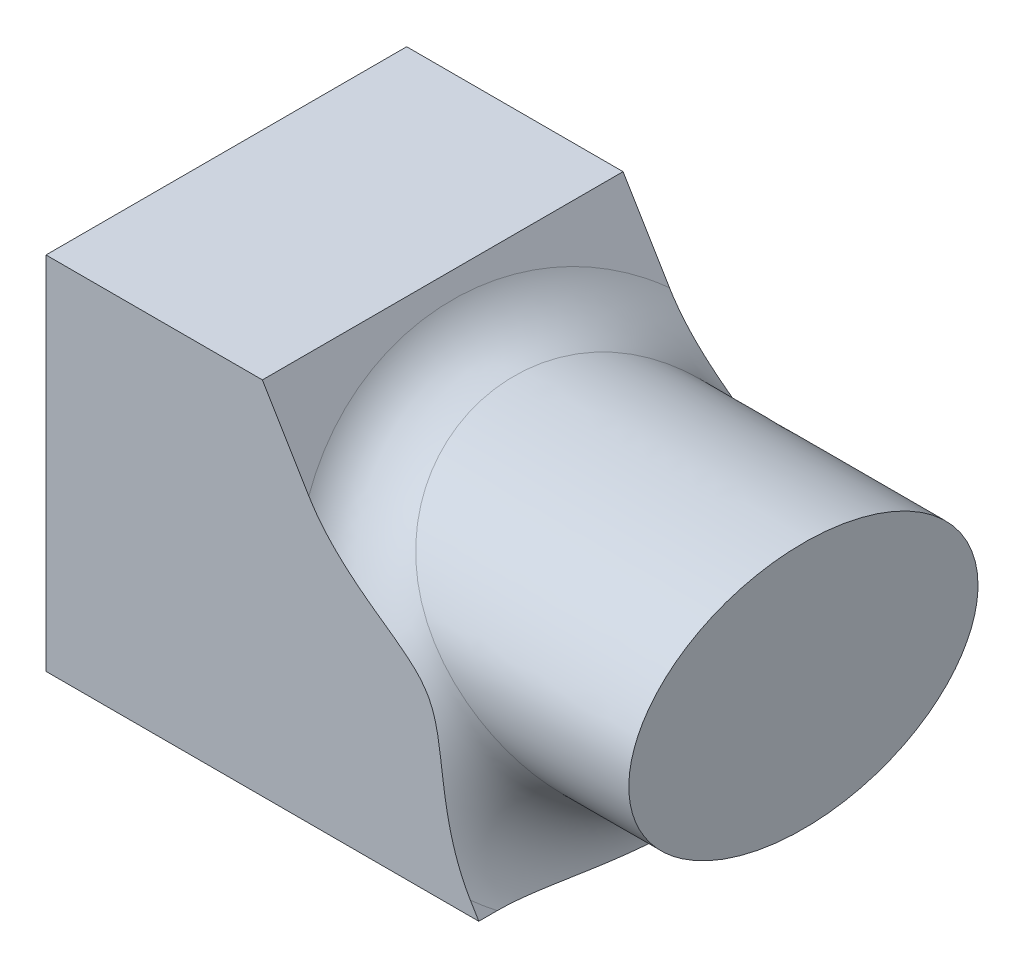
SolidWorks part; units mm, degrees
ref_plane "Front" through (0, 0, 0) normal (0, 0, 1) x (1, 0, 0)
ref_plane "Top" through (0, 0, 0) normal (0, 1, 0) x (1, 0, 0)
ref_plane "Right" through (0, 0, 0) normal (1, 0, 0) x (0, 0, -1)
sketch "Sketch2" plane through (0, 0, 0) normal (0, 0, 1) x (1, 0, 0)
  line L0 (0, 0) -> (60, 0)
  line L1 (60, 0) -> (30, 50)
  line L2 (30, 50) -> (0, 50)
  line L3 (0, 50) -> (0, 0)
  dimension "D1" = 50
  dimension "D2" = 60
  dimension "D3" = 30
extrude "Extrude2" add sketch "Sketch2" along normal mid plane 50
ref_plane "Plane1" through (80, 0, 0) normal (1, 0, 0) x (0, 0, -1)
sketch "Sketch4" plane through (80, 0, 0) normal (1, 0, 0) x (0, 0, -1)
  ellipse E0 centre (0, 25.7579) end of major axis (24.2033, 25.7579) minor radius 17.1677
extrude "Extrude3" add sketch "Sketch4" against normal up to surface (35.4548 mm away)
fillet "Fillet1" radius 10 1 edges at (43.886, 26.8567, 24.1537)
